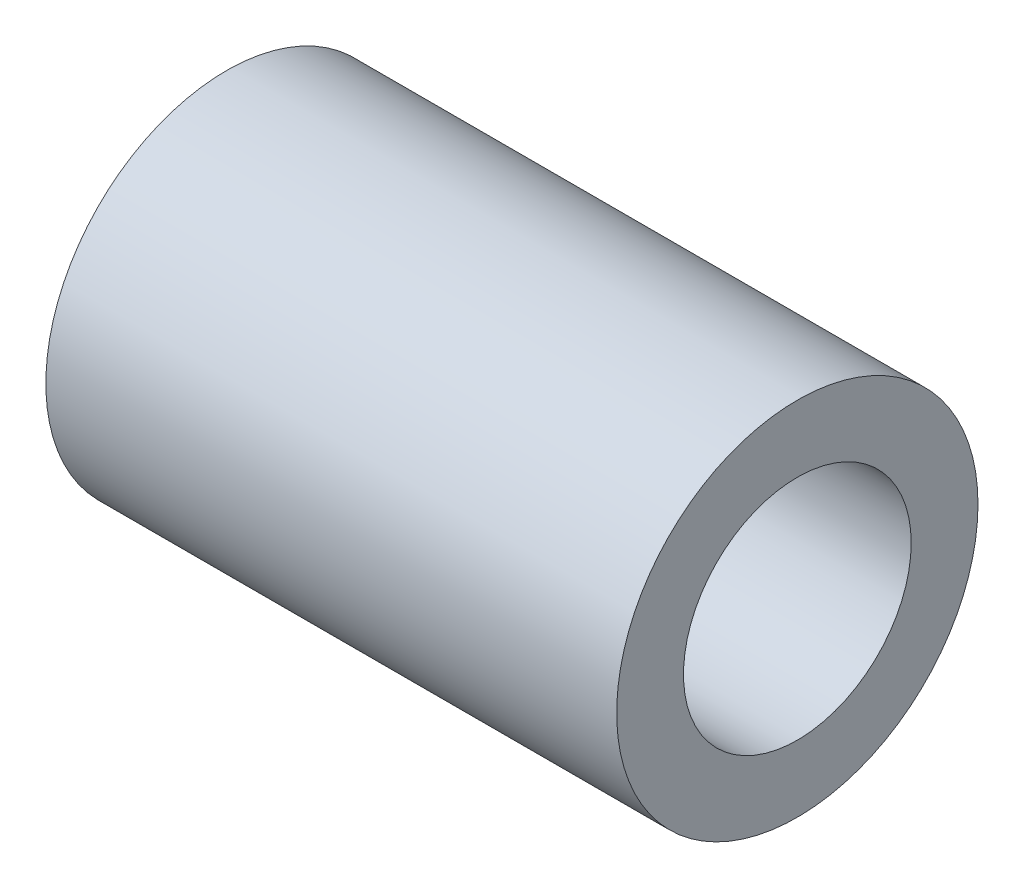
SolidWorks part; units mm, degrees
ref_plane "Front Plane" through (0, 0, 0) normal (0, 0, 1) x (1, 0, 0)
ref_plane "Top Plane" through (0, 0, 0) normal (0, 1, 0) x (1, 0, 0)
ref_plane "Right Plane" through (0, 0, 0) normal (1, 0, 0) x (0, 0, -1)
sketch "Sketch1" plane through (0, 0, 0) normal (1, 0, 0) x (0, 0, -1)
  circle A0 centre (0, 0) radius 15.113
  circle A1 centre (0, 0) radius 9.525
  dimension "D1" = 30.226
  dimension "D2" = 19.05
extrude "Extrude1" add sketch "Sketch1" along normal mid plane 47.752
